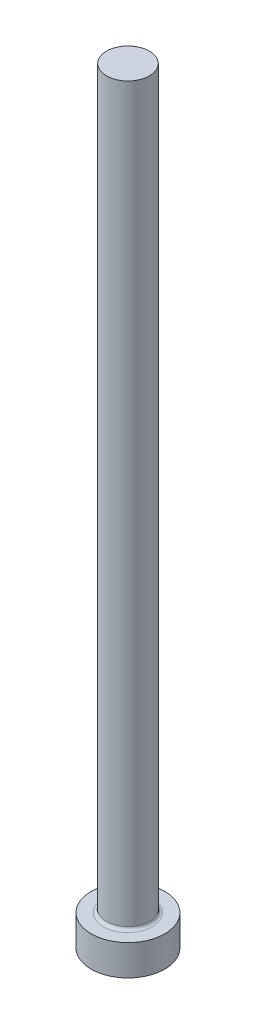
SolidWorks part; units mm, degrees
ref_plane "Plano frontal" through (0, 0, 0) normal (0, 0, 1) x (1, 0, 0)
ref_plane "Plano superior" through (0, 0, 0) normal (0, 1, 0) x (1, 0, 0)
ref_plane "Plano direito" through (0, 0, 0) normal (1, 0, 0) x (0, 0, -1)
sketch "Esboço1" plane through (0, 0, 0) normal (0, 0, 1) x (1, 0, 0)
  line L0 (0, 0) -> (6, 0)
  line L1 (6, 0) -> (6, 5)
  line L2 (6, 5) -> (4, 5)
  line L3 (3.5, 5.5) -> (3.5, 125)
  line L4 (3.5, 125) -> (0, 125)
  line L5 (0, 125) -> (0, 0) construction
  line L6 (0, 0) -> (0, 125)
  arc A0 (4, 5) -> (3.5, 5.5) centre (4, 5.5) cw
  dimension "D3" = 0.5
  dimension "D1" = 12
  dimension "D2" = 7
  dimension "D4" = 5
  dimension "D5" = 125
revolve "Revolução1" add sketch "Esboço1" angle 360 about L5
sketch "Esboço2"
  dimension "D1" = 1.05
  dimension "D2" = 0.675
  dimension "D3" = 3.225
  dimension "D4" = 0.45
wrap "Envolver1" sketch "Esboço2" wrap type deboss source sketch "Esboço2" thickness 0.1 parameters "D1"=0.1
